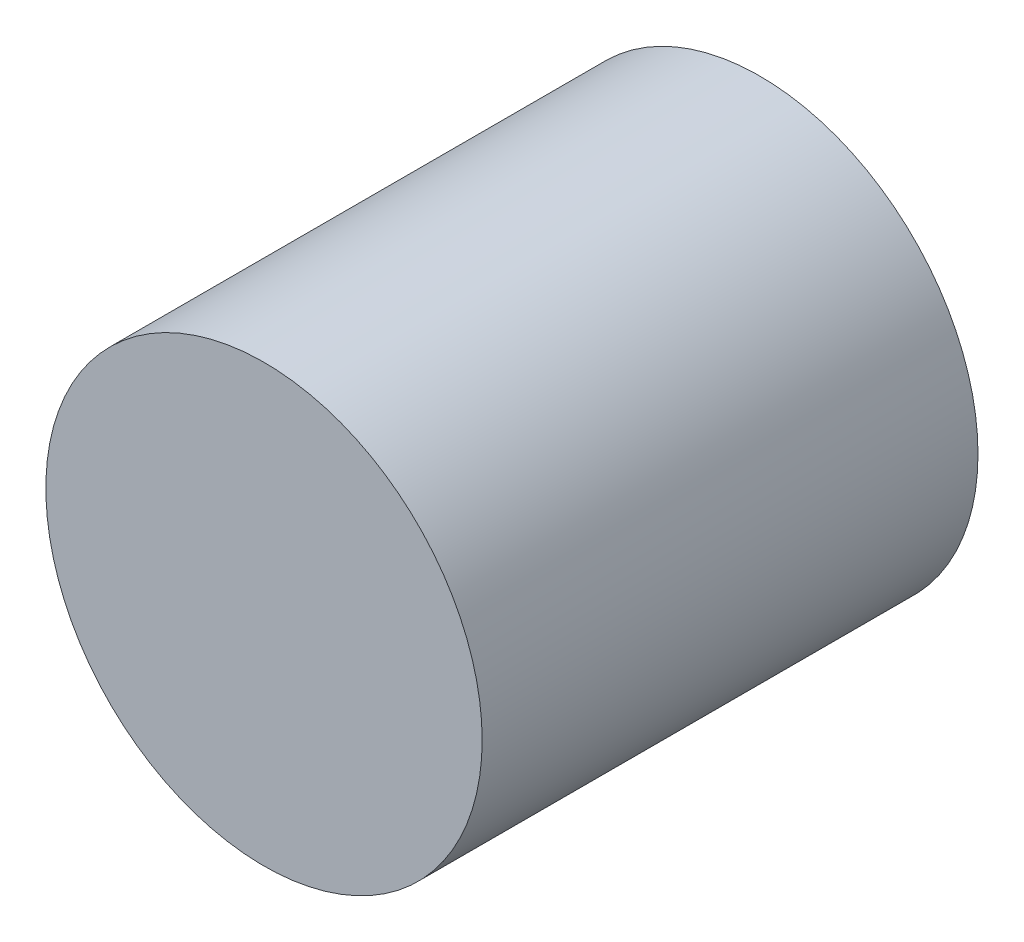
SolidWorks part; units mm, degrees
ref_plane "Plan de face" through (0, 0, 0) normal (0, 0, 1) x (1, 0, 0)
ref_plane "Plan de dessus" through (0, 0, 0) normal (0, 1, 0) x (1, 0, 0)
ref_plane "Plan de droite" through (0, 0, 0) normal (1, 0, 0) x (0, 0, -1)
sketch "Esquisse1" plane through (0, 0, 0) normal (0, 0, 1) x (1, 0, 0)
  line L0 (195.9256, 22) -> (195.9256, -22) construction
  line L1 (155.9256, 22) -> (235.9256, 22) construction
  line L2 (235.9256, -22) -> (155.9256, -22) construction
  circle A0 centre (195.9256, 0) radius 22
extrude "Extrusion1" add sketch "Esquisse1" along normal mid plane 50
